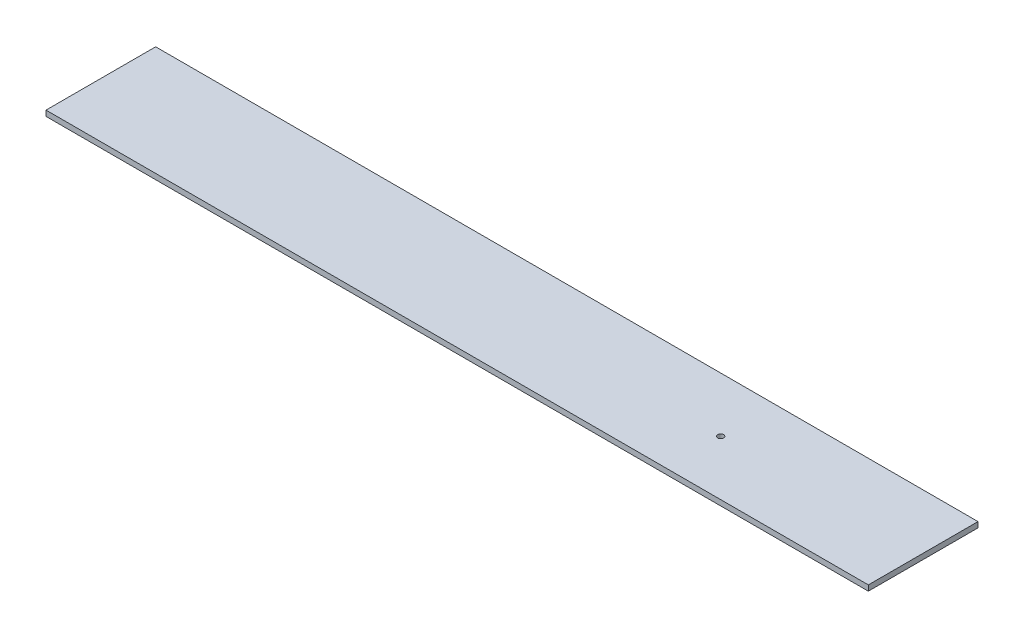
SolidWorks part; units mm, degrees
ref_plane "Front Plane" through (0, 0, 0) normal (0, 0, 1) x (1, 0, 0)
ref_plane "Top Plane" through (0, 0, 0) normal (0, 1, 0) x (1, 0, 0)
ref_plane "Right Plane" through (0, 0, 0) normal (1, 0, 0) x (0, 0, -1)
sketch "Sketch1" plane through (0, 0, 0) normal (0, 1, 0) x (1, 0, 0)
  line L1 (12500, -1000) -> (-2500, -1000)
  line L2 (12500, -1000) -> (12500, 1000)
  line L3 (12500, 1000) -> (-2500, 1000)
  line L4 (-2500, -1000) -> (-2500, 1000)
  line L5 (12500, -1000) -> (-12500, 1000) construction
  line L6 (12500, 1000) -> (-12500, -1000) construction
  point P0 (0, 0)
  dimension "D1" = 2000
  dimension "D2" = 15000
extrude "Main" add sketch "Sketch1" against normal blind 100
sketch "Sketch2" plane through (0, 0, 0) normal (0, 1, 0) x (1, 0, 0)
  circle A0 centre (8806.34, -0.0004) radius 53.975
  dimension "D1" = 107.95
  dimension "D2" = 9000
extrude "Golf Hole" cut sketch "Sketch2" against normal blind 110
sketch "Sketch3" plane through (0, 0, 0) normal (0, 1, 0) x (1, 0, 0)
  line L0 (-2500, 1000) -> (-2500, -1000) construction
  circle A0 centre (-193.66, 0) radius 4
  dimension "D1" = 2306.34
extrude "Tee Hole" cut sketch "Sketch3" against normal blind 43.6
